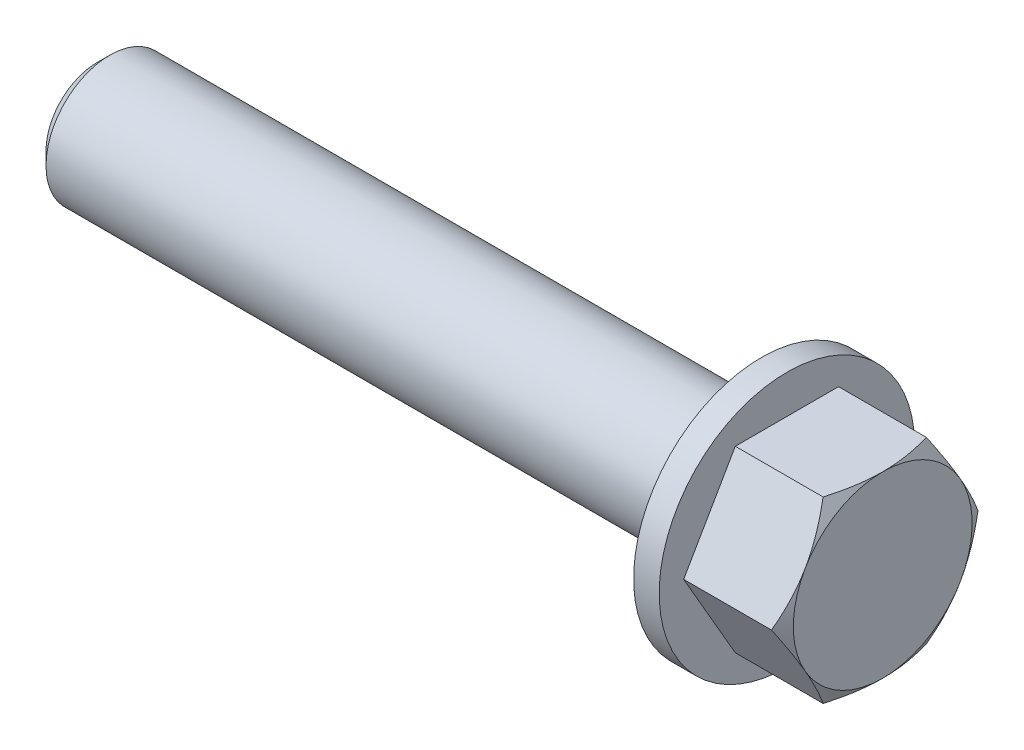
SolidWorks part; units mm, degrees
ref_plane "Face" through (0, 0, 0) normal (0, 0, 1) x (1, 0, 0)
ref_plane "Dessus" through (0, 0, 0) normal (0, 1, 0) x (1, 0, 0)
ref_plane "Droite" through (0, 0, 0) normal (1, 0, 0) x (0, 0, -1)
sketch "Esquisse1" plane through (0, 0, 0) normal (1, 0, 0) x (0, 0, -1)
  line L0 (8.0829, 0) -> (4.0415, 7)
  line L1 (4.0415, 7) -> (-4.0415, 7)
  line L2 (-4.0415, 7) -> (-8.0829, 0)
  line L3 (-8.0829, 0) -> (-4.0415, -7)
  line L4 (-4.0415, -7) -> (4.0415, -7)
  line L5 (4.0415, -7) -> (8.0829, 0)
  line L6 (0, 0) -> (31, 0) construction
  circle A0 centre (0, 0) radius 8.0829 construction
  dimension "D1" = 14
extrude "Base-Extrusion" add sketch "Esquisse1" along normal blind 7.5
sketch "Esquisse2" plane through (0, 0, 0) normal (-1, 0, 0) x (0, 0, 1)
  circle A0 centre (0, 0) radius 5
  dimension "D1" = 10
extrude "Boss.-Extru.1" add sketch "Esquisse2" along normal blind 54
sketch "Esquisse3" plane through (0, 0, 0) normal (0, 0, 1) x (1, 0, 0)
  line L0 (7.5, -7) -> (0, -19.9904)
  line L1 (0, -19.9904) -> (7.5, -19.9904)
  line L2 (7.5, -19.9904) -> (7.5, -7)
  line L3 (3.75, -13.4952) -> (7.5, -19.9904) construction
  line L4 (0, 0) -> (0, -7) construction
  line L5 (0, 0) -> (12.7759, 0) construction
  line L6 (-54, 0) -> (0, 0) construction
revolve "Enlèvement de matière-Révolution1" cut sketch "Esquisse3" angle 360 about L5
chamfer "Chanfrein1" distance 1 angle 45 1 edges at (-54, 0, 5)
sketch "Esquisse4" plane through (0, 0, 0) normal (0, 0, 1) x (1, 0, 0)
  line L0 (0, 0) -> (-110.7549, 0) construction
  line L2 (0, 0) -> (-2, 0)
  line L3 (0, 0) -> (0, 10)
  line L4 (0, 10) -> (-2, 10)
  line L5 (-2, 0) -> (-2, 10)
  dimension "D1" = 2
  dimension "D2" = 20
revolve "Révolution1" add sketch "Esquisse4" angle 360 about L0
sketch "Esquisse5" plane through (0, 0, 0) normal (0, 0, 1) x (1, 0, 0)
  line L0 (-2, 5) -> (-2, -5) construction
  line L1 (-2, 0) -> (-36, 0)
  line L2 (-2, 0) -> (-2, 5)
  line L3 (-2, 5) -> (-36, 5)
  line L4 (-36, 0) -> (-36, 5)
  line L5 (0, 0) -> (-308.1157, 0) construction
  dimension "D1" = 10
  dimension "D2" = 34
revolve "Révolution2" add sketch "Esquisse5" angle 360 about L5
fillet "Congé1" radius 1
equation "\"D2@Représentation de filetage1\" = 0.8*\"D1@Esquisse2\""
equation "\"D1@Chanfrein1\" = 0.1*\"D1@Esquisse2\""
